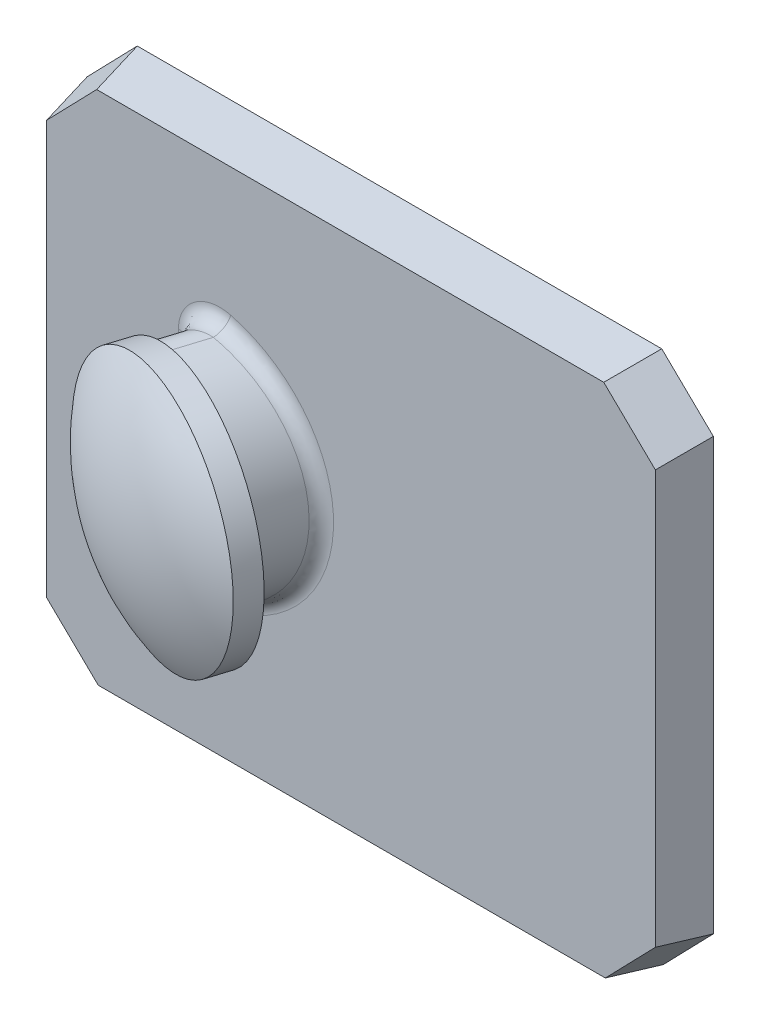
SolidWorks part; units mm, degrees
ref_plane "Front" through (0, 0, 0) normal (0, 0, 1) x (1, 0, 0)
ref_plane "Top" through (0, 0, 0) normal (0, 1, 0) x (1, 0, 0)
ref_plane "Right" through (0, 0, 0) normal (1, 0, 0) x (0, 0, -1)
sketch "Sketch1" plane through (0, 0, 0) normal (0, 0, 1) x (1, 0, 0)
  line L0 (95.201, -25.4) -> (95.201, 25.4) construction
  line L1 (95.201, -5.4) -> (107.9, -5.4)
  line L2 (95.201, -5.4) -> (95.201, 5.4)
  line L3 (95.201, 5.4) -> (107.9, 5.4)
  line L4 (107.9, -5.4) -> (107.9, 5.4)
  line L5 (107.9, 25.4) -> (107.9, -13.8378) construction
  line L6 (107.9, -25.4) -> (95.201, -25.4) construction
  line L7 (107.9, 25.4) -> (95.201, 25.4) construction
  point P10 (101.5505, 25.4)
  dimension "D1" = 20
  dimension "D2" = 20
extrude "Extrude1" add sketch "Sketch1" along normal blind 1 draft 10
ref_plane "Plane1" through (8.3263, 0, -26.4269) normal (-0.3005, 0, 0.9538) x (0.9538, 0, 0.3005)
sketch "Sketch2" plane through (8.3263, 0, -26.4269) normal (-0.3005, 0, 0.9538) x (0.9538, 0, 0.3005)
  line L1 (94.2101, 1.8482) -> (94.2101, -1.8179)
  arc A0 (94.8416, -2.3003) -> (94.8416, 2.3305) centre (94.2101, 0.0151) ccw
  arc A1 (94.2101, 1.8482) -> (94.8416, 2.3305) centre (94.7101, 1.8482) cw
  arc A2 (94.8416, -2.3003) -> (94.2101, -1.8179) centre (94.7101, -1.8179) cw
  dimension "D1" = 0.5
extrude "Extrude2" add sketch "Sketch2" against normal up to next
sketch "Sketch3" plane through (0, 0, 0) normal (0, 1, 0) x (1, 0, 0)
  line L2 (99.5884, -1.2792) -> (98.9354, -3.3517) construction
  line L3 (99.3117, -2.1572) -> (101.6976, -2.9089)
  line L4 (101.6976, -2.9089) -> (101.5474, -3.3855)
  line L5 (99.3117, -2.1572) -> (98.9354, -3.3517)
  arc A0 (101.5474, -3.3855) -> (98.9354, -3.3517) centre (100.2975, 0.9715) cw
revolve "Revolve2" add sketch "Sketch3" angle 360 about L2
fillet "Fillet2" radius 0.3 4 edges at (98.4604, 0.0151, 1) (98.6664, 2.2455, 1) (98.6664, -2.2152, 1) (100.9767, 0.0151, 1)
chamfer "Chamfer1" distance 1 angle 45 4 edges at (95.2892, 5.3118, 0.5) (107.8118, 5.3118, 0.5) (107.8118, -5.3118, 0.5) (95.2892, -5.3118, 0.5)
